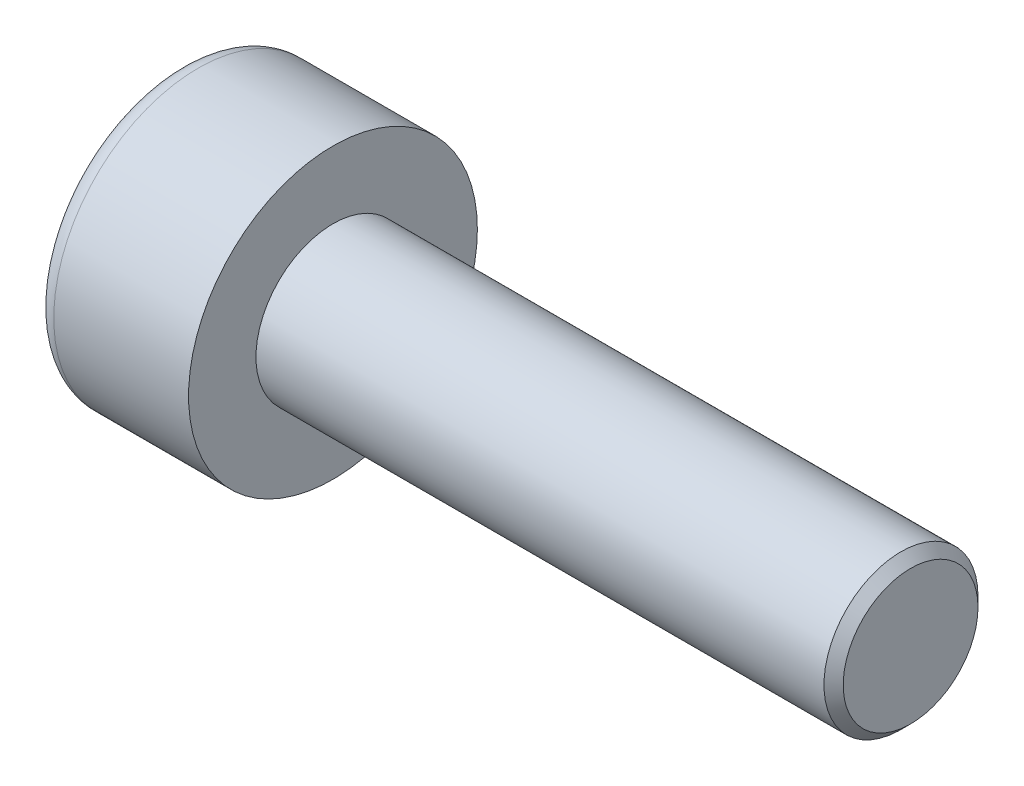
SolidWorks part; units mm, degrees
ref_plane "Front" through (0, 0, 0) normal (0, 0, 1) x (1, 0, 0)
ref_plane "Top" through (0, 0, 0) normal (0, 1, 0) x (1, 0, 0)
ref_plane "Right" through (0, 0, 0) normal (1, 0, 0) x (0, 0, -1)
sketch "Sketch1" plane through (0, 0, 0) normal (1, 0, 0) x (0, 0, -1)
  circle A0 centre (0, 0) radius 1.5
  dimension "dk" = 3
extrude "BaseHead" add sketch "Sketch1" along normal blind 1.6
sketch "Sketch2" plane through (1.6, 0, 0) normal (1, 0, 0) x (0, 0, -1)
  circle A0 centre (0, 0) radius 0.8
  dimension "d" = 1.6
extrude "BaseBody" add sketch "Sketch2" along normal blind 6
sketch "Sketch3" plane through (0, 0, 0) normal (1, 0, 0) x (0, 0, -1)
  line L1 (0.866, 0) -> (0.433, 0.75)
  line L2 (0.433, 0.75) -> (-0.433, 0.75)
  line L3 (-0.433, 0.75) -> (-0.866, 0)
  line L4 (-0.866, 0) -> (-0.433, -0.75)
  line L5 (-0.433, -0.75) -> (0.433, -0.75)
  line L6 (0.433, -0.75) -> (0.866, 0)
  circle A0 centre (0, 0) radius 0.75 construction
  dimension "s" = 1.5
  dimension "e" = 1.7321
extrude "HexagonSocket" cut sketch "Sketch3" along normal blind 0.7
sketch "Sketch4" plane through (-4.1961, 0.75, 0) normal (0, 0, 1) x (-1, 0, 0)
  line L0 (-4.8961, 1.5) -> (-5.3292, 0.75)
  line L2 (-5.3292, 0.75) -> (-4.8961, 0.75)
  line L3 (-4.8961, 0.75) -> (-4.8961, 1.5)
  line L4 (-5.0351, 0.75) -> (0.839, 0.75) construction
  line L5 (-11.7961, 0.75) -> (-5.7961, 0.75) construction
  line L6 (-5.7961, 0.75) -> (-4.1961, 0.75) construction
  dimension "m" = 60
revolve "Cut-Revolve1" cut sketch "Sketch4" angle 360 about L4
fillet "HeadFillet" [suppressed] radius 0.1
fillet "TopFillet" radius 0.2 1 edges at (0, 0, -1.5)
chamfer "Chamfer1" distance 0.1 angle 45 1 edges at (7.6, 0, -0.8)
sketch "Sketch5" plane through (0, 0, 0) normal (0, 0, 1) x (1, 0, 0)
  line L0 (7.5, 0.6359) -> (7.5947, 0.8)
  line L1 (7.5947, 0.8) -> (7.5947, 0.9895)
  line L2 (7.5947, 0.9895) -> (7.4052, 0.9895)
  line L3 (7.4052, 0.9895) -> (7.4052, 0.8)
  line L4 (7.4052, 0.8) -> (7.5, 0.6359)
  line L5 (0, 0) -> (7.8886, 0) construction
  line L6 (7.5, -0.8) -> (7.5, 0.8) construction
  dimension "D1" = 1.6
  dimension "D2" = 0.1895
revolve "Cut-Revolve10" [suppressed] cut sketch "Sketch5" angle 360 about L5
pattern_linear "LPattern10" [suppressed] count 26 spacing 0.2274 along (1, 0, 0)
equation "\"r1@TopFillet\" = \"d@Sketch2\" / 8"
equation "\"D1@Chamfer1\" = \"r@HeadFillet\""
equation "\"D1@Sketch5\" = \"d@Sketch2\""
equation "\"D2@Sketch5\" =  ( \"d@Sketch2\" - \"D2@ThreadCosmetic1\" )  / 2"
equation "\"D3@LPattern10\" = \"D2@Sketch5\" * 1.2"
equation "\"D1@LPattern10\" = \"b@ThreadCosmetic1\" / \"D3@LPattern10\""
